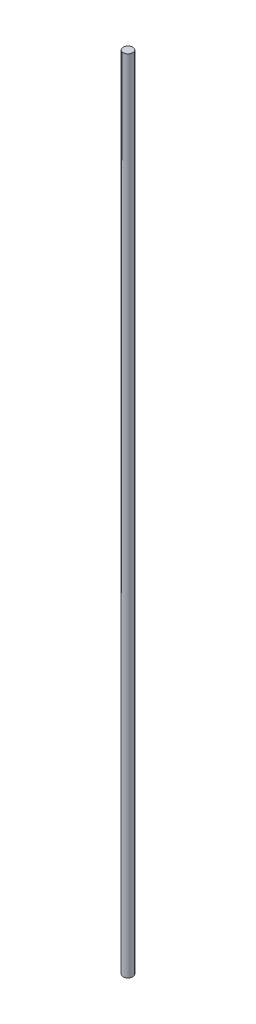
SolidWorks part; units mm, degrees
ref_plane "Plan de face" through (0, 0, 0) normal (0, 0, 1) x (1, 0, 0)
ref_plane "Plan de dessus" through (0, 0, 0) normal (0, 1, 0) x (1, 0, 0)
ref_plane "Plan de droite" through (0, 0, 0) normal (1, 0, 0) x (0, 0, -1)
sketch "Esquisse1" plane through (0, 0, 0) normal (0, 1, 0) x (1, 0, 0)
  circle A0 centre (0, 0) radius 6
  dimension "D1" = 12
extrude "Extrusion1" add sketch "Esquisse1" along normal mid plane 1000
